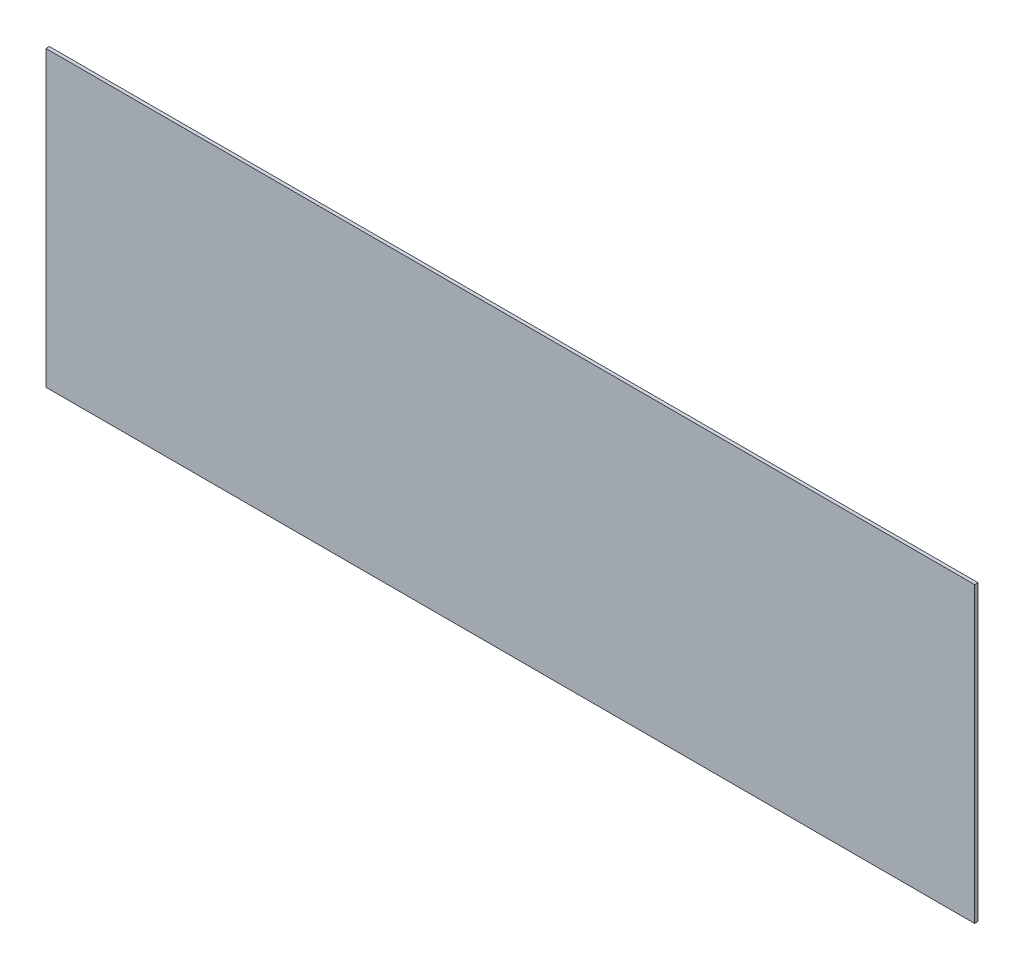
SolidWorks part; units mm, degrees
ref_plane "Front Plane" through (0, 0, 0) normal (0, 0, 1) x (1, 0, 0)
ref_plane "Top Plane" through (0, 0, 0) normal (0, 1, 0) x (1, 0, 0)
ref_plane "Right Plane" through (0, 0, 0) normal (1, 0, 0) x (0, 0, -1)
sketch "Sketch1" plane through (0, 0, 0) normal (0, 0, 1) x (1, 0, 0)
  line L1 (0, 0) -> (562.61, 0)
  line L2 (0, 0) -> (0, 177.8)
  line L3 (0, 177.8) -> (562.61, 177.8)
  line L4 (562.61, 0) -> (562.61, 177.8)
  dimension "D1" = 177.8
  dimension "D2" = 562.61
extrude "Boss-Extrude1" add sketch "Sketch1" along normal blind 2.032
